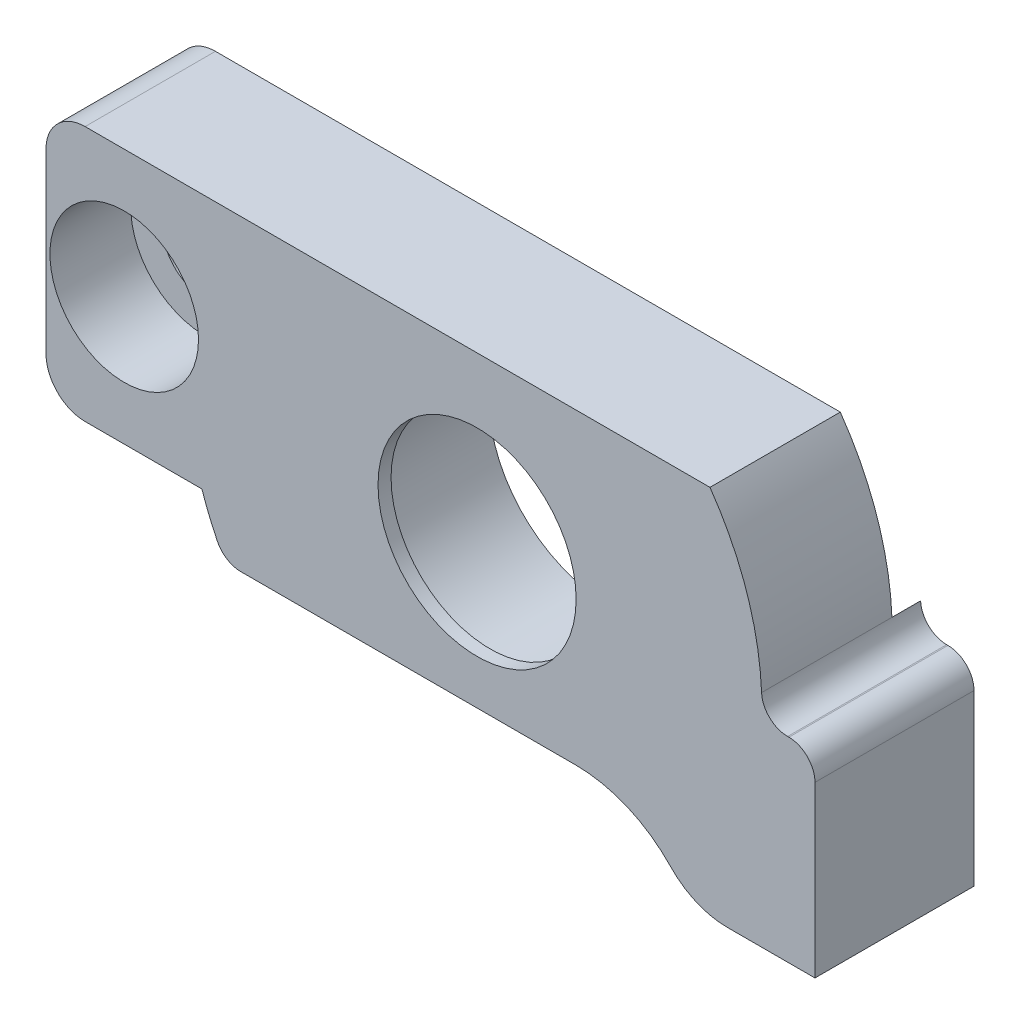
SolidWorks part; units mm, degrees
ref_plane "Plano frontal" through (0, 0, 0) normal (0, 0, 1) x (1, 0, 0)
ref_plane "Plano superior" through (0, 0, 0) normal (0, 1, 0) x (1, 0, 0)
ref_plane "Plano direito" through (0, 0, 0) normal (1, 0, 0) x (0, 0, -1)
sketch "Esboço1" plane through (0, 0, 0) normal (0, 0, 1) x (1, 0, 0)
  line L0 (-5.5, -4.8) -> (-5.5, -4.9)
  line L2 (-12.5, -2.4) -> (-12.5, 4.4)
  line L3 (-11, 5.9) -> (11, 5.9)
  line L5 (0, 0) -> (0, 8.0295) construction
  line L6 (0, 0) -> (16.4431, 0) construction
  line L7 (-4.5, -5.9) -> (11, -5.9)
  line L8 (12.5, -4.4) -> (12.5, 4.4)
  line L9 (-11, -3.9) -> (-6.4, -3.9)
  arc A10 (12.5, -4.4) -> (11, -5.9) centre (11, -4.4) cw
  arc A11 (11, 5.9) -> (12.5, 4.4) centre (11, 4.4) cw
  arc A12 (-12.5, -2.4) -> (-11, -3.9) centre (-11, -2.4) ccw
  arc A13 (-12.5, 4.4) -> (-11, 5.9) centre (-11, 4.4) cw
  arc A14 (-5.5, -4.8) -> (-6.4, -3.9) centre (-6.4, -4.8) ccw
  arc A15 (-4.5, -5.9) -> (-5.5, -4.9) centre (-4.5, -4.9) cw
  point P0 (0, 0)
  point P1 (0, 5.9)
  point P6 (12.5, 0)
  dimension "D3" = 0.9
  dimension "D4" = 2
  dimension "D5" = 18
  dimension "D6" = 1
  dimension "D7" = 1.5
  dimension "D1" = 9.8
  dimension "D2" = 25
extrude "Ressalto-extrusão1" add sketch "Esboço1" along normal blind 5
sketch "Esboço2" plane through (0, 0, 5) normal (0, 0, 1) x (1, 0, 0)
  circle A1 centre (4.0367, -0.3872) radius 3 construction
  circle A2 centre (4.0367, -0.3872) radius 3 construction
  circle A7 centre (4.0367, -0.3872) radius 3.8
  circle A10 centre (-9.5, 1) radius 1.65
  circle A11 centre (-9.5, 1) radius 1.25 construction
  dimension "D1" = 7.6
  dimension "D2" = 3.3
extrude "Corte-extrusão1" cut sketch "Esboço2" against normal blind 5
sketch "Esboço3" plane through (0, 0, 5) normal (0, 0, -1) x (-1, 0, 0)
  circle A0 centre (9.5, 1) radius 2.85
  circle A1 centre (9.5, 1) radius 1.25 construction
  dimension "D1" = 5.7
extrude "Corte-extrusão2" cut sketch "Esboço3" along normal blind 3.1
sketch "Esboço4" plane through (0, 0, 0) normal (0, 0, -1) x (-1, 0, 0)
  circle A1 centre (-4.0367, -0.3872) radius 4.55
  dimension "D1" = 9.1
extrude "Corte-extrusão3" cut sketch "Esboço4" against normal offset from surface (4.5 mm away) 0.5
sketch "Esboço5" plane through (0, 0, 5) normal (0, 0, 1) x (1, 0, 0)
  line L0 (15.2617, -0.3872) -> (17, -0.3872) construction
  line L1 (17, -16.185) -> (17, -0.3872) construction
  line L2 (15.2617, -0.3872) -> (17, -0.3872)
  line L3 (17, -16.185) -> (17, -0.3872)
  arc A0 (12.8897, -7.2883) -> (12.8589, -10.9369) centre (15.2557, -9.1327) ccw construction
  arc A1 (12.8897, -7.2883) -> (15.2617, -0.3872) centre (4.0367, -0.3872) ccw construction
  arc A2 (15.2617, -0.3872) -> (6.787, 10.4957) centre (4.0367, -0.3872) ccw construction
  arc A3 (12.8897, -7.2883) -> (12.8589, -10.9369) centre (15.2557, -9.1327) ccw
  arc A4 (12.8897, -7.2883) -> (15.2617, -0.3872) centre (4.0367, -0.3872) ccw
  arc A5 (15.2617, -0.3872) -> (6.787, 10.4957) centre (4.0367, -0.3872) ccw
sketch "Esboço6" plane through (0, 0, 5) normal (0, 0, 1) x (1, 0, 0)
  line L0 (14.9617, -0.8872) -> (17, -0.8872)
  line L1 (17, -16.185) -> (17, -0.3872) construction
  line L2 (17, -0.8872) -> (17, -8.3872)
  line L4 (-4.5, -5.9) -> (11, -5.9) construction
  line L5 (11, 5.9) -> (12.9713, 5.9)
  line L6 (12.5, -4.4) -> (12.5, 4.4) construction
  line L7 (7.822, -5.9) -> (11, -5.9)
  line L8 (12.5, -4.4) -> (12.5, 4.4)
  line L9 (14.9617, -0.8872) -> (14.9617, -0.3872)
  line L10 (17, -8.3872) -> (12.1659, -8.3872)
  arc A1 (12.1659, -8.3872) -> (7.822, -5.9) centre (7.822, -10.9369) ccw
  arc A2 (14.9617, -0.3872) -> (6.7135, 10.2048) centre (4.0367, -0.3872) ccw
  arc A3 (14.9617, -0.3872) -> (12.9713, 5.9) centre (4.0367, -0.3872) ccw
  arc A4 (11, -5.9) -> (12.5, -4.4) centre (11, -4.4) ccw construction
  arc A5 (12.5, 4.4) -> (11, 5.9) centre (11, 4.4) ccw construction
  arc A6 (11, -5.9) -> (12.5, -4.4) centre (11, -4.4) ccw
  arc A7 (12.5, 4.4) -> (11, 5.9) centre (11, 4.4) ccw
  dimension "D2" = 0.5
  dimension "D3" = 7.5
  dimension "D4" = 4.3439
  dimension "D5" = 4.8341
  dimension "D1" = 0.3
extrude "Ressalto-extrusão2" add sketch "Esboço6" against normal blind 7.4
fillet "Filete1" radius 1 2 edges at (17, -0.8872, 1.3) (14.9617, -0.8872, 1.3)
fillet "Filete2" radius 3 1 edges at (12.1659, -8.3872, 1.3)
sketch "Esboço7" plane through (0, 0, -2.4) normal (0, 0, -1) x (-1, 0, 0)
  line L0 (-12.5, 4.4) -> (-12.5, 5.9)
  line L1 (-7.822, -5.9) -> (-11, -5.9) construction
  line L2 (-7.822, -5.9) -> (-11, -5.9)
  line L3 (-12.5, -4.4) -> (-12.5, -8.1641)
  line L6 (-17, -8.3872) -> (-13.6351, -8.3872)
  line L7 (-7.822, -5.9) -> (-11, -5.9)
  line L8 (-12.5, -4.4) -> (-12.5, 4.4)
  line L9 (-11, 5.9) -> (-12.9713, 5.9)
  line L10 (-15.9512, -0.8872) -> (-16, -0.8872)
  line L11 (-17, -1.8872) -> (-17, -8.3872)
  line L15 (-11, 5.9) -> (-12.5, 5.9)
  line L16 (-15.9512, -0.8872) -> (-16, -0.8872)
  arc A0 (-13.6351, -8.3872) -> (-11.4652, -7.4588) centre (-13.6351, -5.3872) ccw construction
  arc A1 (-12.5, -4.4) -> (-11, -5.9) centre (-11, -4.4) ccw construction
  arc A2 (-7.822, -5.9) -> (-11.4652, -7.4588) centre (-7.822, -10.9369) ccw construction
  arc A3 (-12.5, -8.1641) -> (-11.4652, -7.4588) centre (-13.6351, -5.3872) ccw
  arc A4 (-12.5, -4.4) -> (-11, -5.9) centre (-11, -4.4) ccw
  arc A5 (-7.822, -5.9) -> (-11.4652, -7.4588) centre (-7.822, -10.9369) ccw
  arc A7 (-13.6351, -8.3872) -> (-11.4652, -7.4588) centre (-13.6351, -5.3872) ccw
  arc A8 (-7.822, -5.9) -> (-11.4652, -7.4588) centre (-7.822, -10.9369) ccw
  arc A9 (-12.5, -4.4) -> (-11, -5.9) centre (-11, -4.4) ccw
  arc A10 (-11, 5.9) -> (-12.5, 4.4) centre (-11, 4.4) ccw
  arc A11 (-12.9713, 5.9) -> (-14.9521, 0.0709) centre (-4.0367, -0.3872) ccw
  arc A12 (-15.9512, -0.8872) -> (-14.9521, 0.0709) centre (-15.9512, 0.1128) ccw
  arc A13 (-16, -0.8872) -> (-17, -1.8872) centre (-16, -1.8872) ccw
  arc A17 (-11, 5.9) -> (-12.5, 4.4) centre (-11, 4.4) ccw
  dimension "D1" = 0
extrude "Corte-extrusão4" cut sketch "Esboço7" against normal up to surface (2.4 mm away) contours A17 L0 L15 | A3 A5 L2 A4 L3
sketch "Esboço8" plane through (0, 0, 5) normal (0, 0, 1) x (1, 0, 0)
  arc A0 (-6.591, -4) -> (-5.0337, -7) centre (4.0367, -0.3872) ccw construction
  arc A1 (-6.591, -4) -> (-5.0337, -7) centre (4.0367, -0.3872) ccw
sketch "Esboço9" plane through (0, 0, 5) normal (0, 0, 1) x (1, 0, 0)
  line L0 (-11, -3.9) -> (-6.4, -3.9) construction
  line L1 (-4.5, -5.9) -> (-5.6264, -5.9)
  line L2 (-6.5192, -3.9) -> (-6.4, -3.9)
  line L3 (-5.5, -4.8) -> (-5.5, -4.9) construction
  line L4 (-5.5, -4.8) -> (-5.5, -4.9)
  arc A2 (-5.5, -4.9) -> (-4.5, -5.9) centre (-4.5, -4.9) ccw construction
  arc A3 (-5.5, -4.8) -> (-6.4, -3.9) centre (-6.4, -4.8) ccw construction
  arc A4 (-5.5, -4.9) -> (-4.5, -5.9) centre (-4.5, -4.9) ccw
  arc A5 (-5.5, -4.8) -> (-6.4, -3.9) centre (-6.4, -4.8) ccw
  arc A6 (-6.5192, -3.9) -> (-5.6264, -5.9) centre (4.0367, -0.3872) ccw
extrude "Ressalto-extrusão4" add sketch "Esboço9" against normal up to surface (5 mm away)
fillet "Filete3" radius 1 1 edges at (-5.6264, -5.9, 2.5)
sketch "Esboço10" [suppressed] plane through (0, 0, -2.4) normal (0, 0, -1) x (-1, 0, 0)
  line L0 (-12.9713, 5.9) -> (-12.5, 5.9) construction
  line L1 (-12.5, 5.9) -> (-12.5, -8.1641) construction
  line L2 (-12.9713, 5.9) -> (-12.5, 5.9)
  line L3 (-12.5, 5.9) -> (-12.5, -7.2957)
  arc A0 (-12.9713, 5.9) -> (-14.9521, 0.0709) centre (-4.0367, -0.3872) ccw construction
  arc A1 (-12.9713, 5.9) -> (-14.9521, 0.0709) centre (-4.0367, -0.3872) ccw
  arc A2 (-12.9713, 5.9) -> (-12.5, -7.2957) centre (-4.0367, -0.3872) ccw
extrude "Corte-extrusão5" [suppressed] cut sketch "Esboço10" against normal up to surface (2.4 mm away)
sketch "Esboço11" [suppressed] plane through (0, 0, -2.4) normal (0, 0, -1) x (-1, 0, 0)
  line L4 (-12.5, -8.1641) -> (-12.5, -7.2957)
  line L5 (-15.9512, -0.8872) -> (-16, -0.8872)
  line L6 (-17, -1.8872) -> (-17, -8.3872)
  line L7 (-17, -8.3872) -> (-13.6351, -8.3872)
  line L8 (-12.5, -8.1641) -> (-12.5, -7.2957)
  line L9 (-15.9512, -0.8872) -> (-16, -0.8872)
  line L10 (-17, -1.8872) -> (-17, -8.3872)
  line L11 (-17, -8.3872) -> (-13.6351, -8.3872)
  arc A4 (-14.9521, 0.0709) -> (-12.5, -7.2957) centre (-4.0367, -0.3872) ccw
  arc A5 (-15.9512, -0.8872) -> (-14.9521, 0.0709) centre (-15.9512, 0.1128) ccw
  arc A6 (-16, -0.8872) -> (-17, -1.8872) centre (-16, -1.8872) ccw
  arc A7 (-13.6351, -8.3872) -> (-12.5, -8.1641) centre (-13.6351, -5.3872) ccw
  arc A8 (-14.9521, 0.0709) -> (-12.5, -7.2957) centre (-4.0367, -0.3872) ccw
  arc A9 (-15.9512, -0.8872) -> (-14.9521, 0.0709) centre (-15.9512, 0.1128) ccw
  arc A10 (-16, -0.8872) -> (-17, -1.8872) centre (-16, -1.8872) ccw
  arc A11 (-13.6351, -8.3872) -> (-12.5, -8.1641) centre (-13.6351, -5.3872) ccw
  dimension "D1" = 0
sketch "Esboço12" plane through (0, 0, -2.4) normal (0, 0, -1) x (-1, 0, 0)
  line L0 (-12.9713, 5.9) -> (-12.5, 5.9) construction
  line L1 (-12.5, -8.1641) -> (-12.5, 5.9) construction
  line L2 (-12.9713, 5.9) -> (-12.5, 5.9)
  line L3 (-12.5, -7.2957) -> (-12.5, 5.9)
  arc A0 (-12.9713, 5.9) -> (-12.5, -7.2957) centre (-4.0367, -0.3872) ccw
extrude "Corte-extrusão6" cut sketch "Esboço12" against normal up to surface (2.4 mm away)
sketch "Esboço13" plane through (0, 0, -2.4) normal (0, 0, -1) x (-1, 0, 0)
  line L4 (-12.5, -8.1641) -> (-12.5, -7.2957)
  line L5 (-15.9512, -0.8872) -> (-16, -0.8872)
  line L6 (-17, -1.8872) -> (-17, -8.3872)
  line L7 (-17, -8.3872) -> (-13.6351, -8.3872)
  line L8 (-12.5, -8.1641) -> (-12.5, -7.2957)
  line L9 (-15.9512, -0.8872) -> (-16, -0.8872)
  line L10 (-17, -1.8872) -> (-17, -8.3872)
  line L11 (-17, -8.3872) -> (-13.6351, -8.3872)
  arc A4 (-14.9521, 0.0709) -> (-12.5, -7.2957) centre (-4.0367, -0.3872) ccw
  arc A5 (-15.9512, -0.8872) -> (-14.9521, 0.0709) centre (-15.9512, 0.1128) ccw
  arc A6 (-16, -0.8872) -> (-17, -1.8872) centre (-16, -1.8872) ccw
  arc A7 (-13.6351, -8.3872) -> (-12.5, -8.1641) centre (-13.6351, -5.3872) ccw
  arc A8 (-14.9521, 0.0709) -> (-12.5, -7.2957) centre (-4.0367, -0.3872) ccw
  arc A9 (-15.9512, -0.8872) -> (-14.9521, 0.0709) centre (-15.9512, 0.1128) ccw
  arc A10 (-16, -0.8872) -> (-17, -1.8872) centre (-16, -1.8872) ccw
  arc A11 (-13.6351, -8.3872) -> (-12.5, -8.1641) centre (-13.6351, -5.3872) ccw
  dimension "D1" = 0
extrude "Corte-extrusão7" cut sketch "Esboço13" against normal blind 1.3
